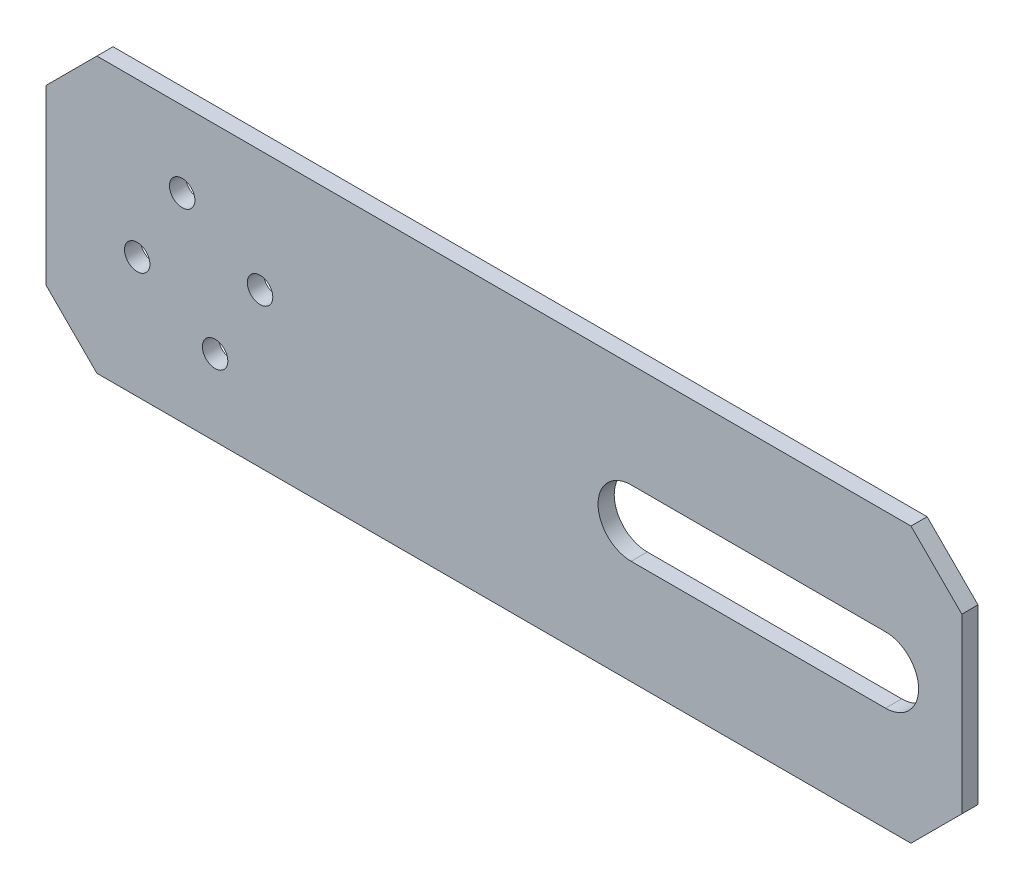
SolidWorks part; units mm, degrees
ref_plane "Front" through (0, 0, 0) normal (0, 0, 1) x (1, 0, 0)
ref_plane "Top" through (0, 0, 0) normal (0, 1, 0) x (1, 0, 0)
ref_plane "Right" through (0, 0, 0) normal (1, 0, 0) x (0, 0, -1)
sketch "Sketch1" plane through (0, 0, 0) normal (0, 0, 1) x (1, 0, 0)
  line L0 (50, 0) -> (-50, 0) construction
  line L1 (-30, 27) -> (150, 27)
  line L2 (-30, 27) -> (-30, -27)
  line L3 (-30, -27) -> (150, -27)
  line L4 (150, 27) -> (150, -27)
  line L5 (-30, 0) -> (0, 0) construction
  line L6 (0, 27) -> (0, -27) construction
  line L7 (-12.0741, -3.2352) -> (12.0741, 3.2352) construction
  line L8 (-3.2352, 12.0741) -> (3.2352, -12.0741) construction
  line L9 (135, 6.5) -> (85, 6.5)
  line L11 (135, -6.5) -> (85, -6.5)
  circle A0 centre (-12.0741, -3.2352) radius 2.5
  circle A1 centre (-3.2352, 12.0741) radius 2.5
  circle A2 centre (3.2352, -12.0741) radius 2.5
  circle A3 centre (12.0741, 3.2352) radius 2.5
  circle A4 centre (0, 0) radius 12.5 construction
  arc A5 (85, 6.5) -> (85, -6.5) centre (85, 0) ccw
  arc A6 (135, -6.5) -> (135, 6.5) centre (135, 0) ccw
  dimension "D3" = 5
  dimension "D6" = 25
  dimension "D7" = 13
  dimension "D8" = 15
  dimension "D9" = 50
  dimension "D1" = 54
  dimension "D2" = 180
  dimension "D4" = 30
  dimension "D5" = 15
extrude "Base-Extrude" add sketch "Sketch1" along normal mid plane 3.175
chamfer "Chamfer1" distance 10 angle 45 4 edges at (-30, 27, 0) (150, 27, 0) (150, -27, 0) (-30, -27, 0)
